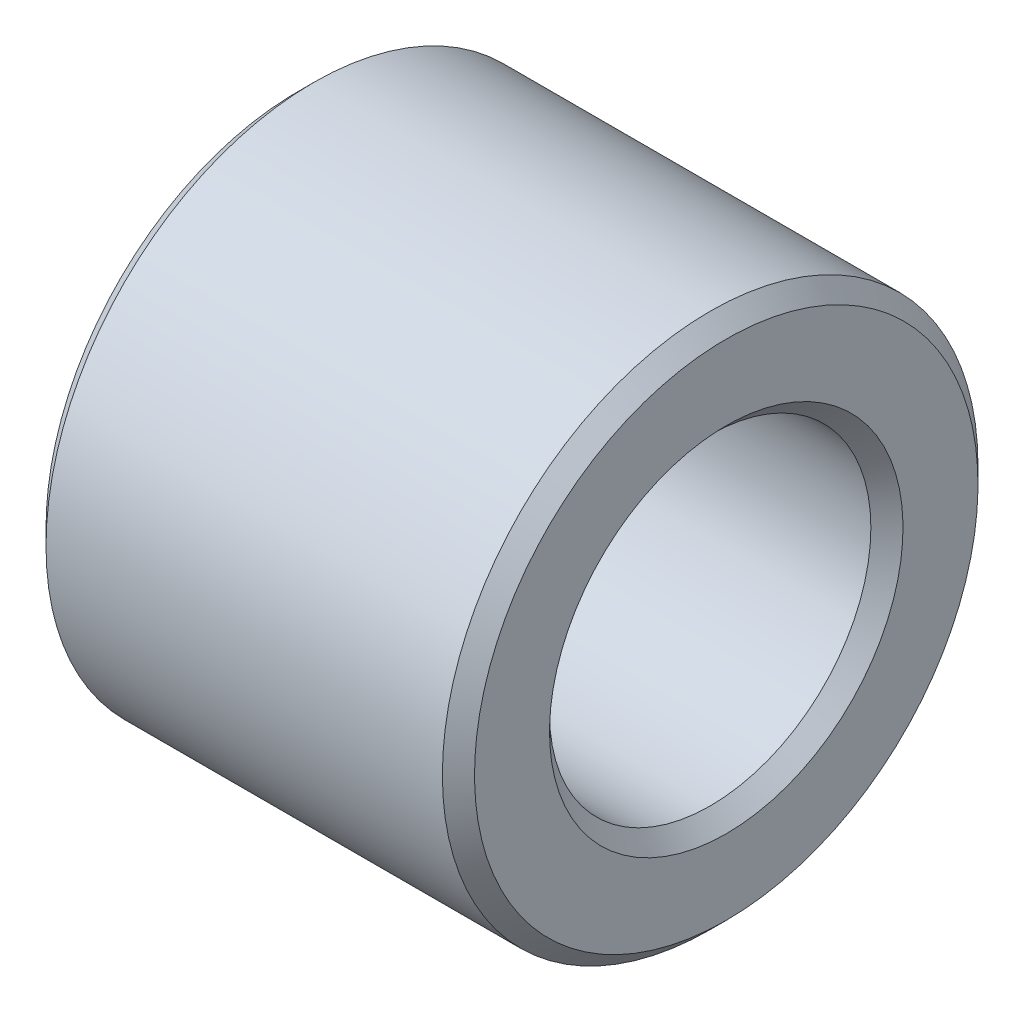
SolidWorks part; units mm, degrees
ref_plane "Plan1" through (0, 0, 0) normal (0, 0, 1) x (1, 0, 0)
ref_plane "Plan2" through (0, 0, 0) normal (0, 1, 0) x (1, 0, 0)
ref_plane "Plan3" through (0, 0, 0) normal (1, 0, 0) x (0, 0, -1)
sketch "Esquisse1" plane through (0, 0, 0) normal (0, 0, 1) x (1, 0, 0)
  line L0 (0, 3.3) -> (0, 4.7)
  line L1 (0, 4.7) -> (0.3, 5)
  line L2 (0.3, 5) -> (7.7, 5)
  line L3 (7.7, 5) -> (8, 4.7)
  line L4 (8, 4.7) -> (8, 3.3)
  line L5 (8, 3.3) -> (7.7, 3)
  line L6 (7.7, 3) -> (0.3, 3)
  line L7 (0.3, 3) -> (0, 3.3)
  line L8 (0, 0) -> (8, 0) construction
  dimension "D1" = 3
  dimension "D2" = 5
  dimension "D3" = 8
  dimension "D4" = 45
  dimension "D5" = 45
  dimension "D6" = 45
  dimension "D7" = 45
revolve "Base-Révolution" add sketch "Esquisse1" angle 360 about L8
